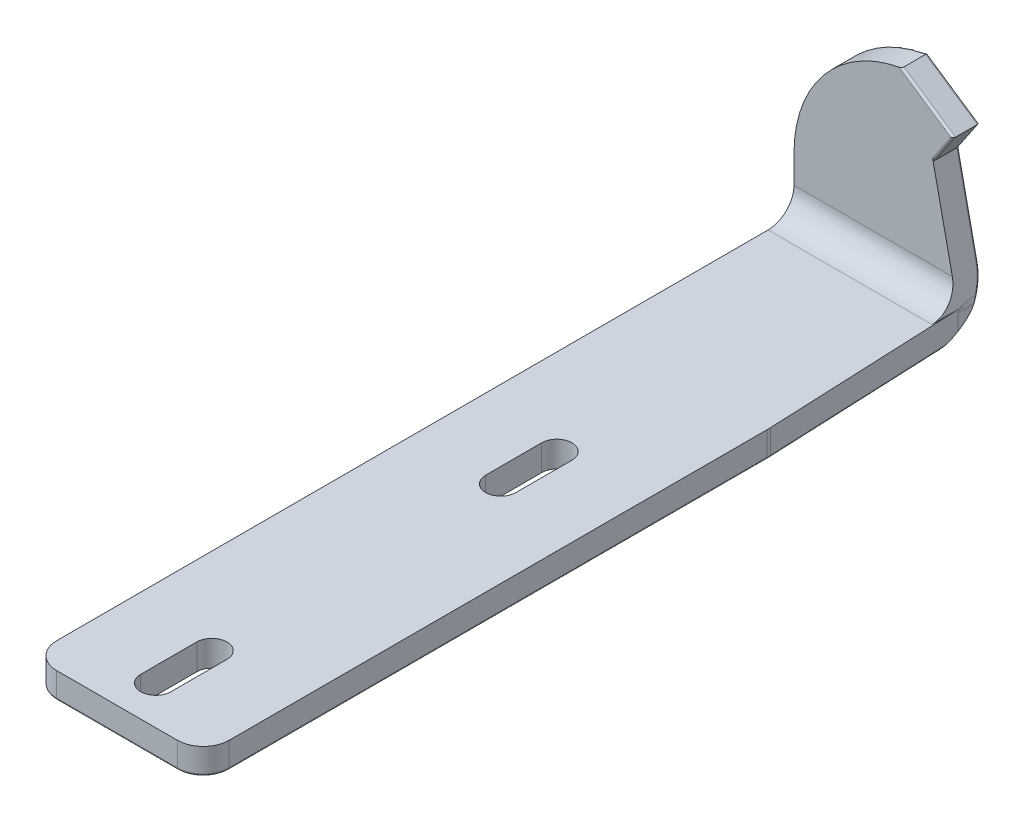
SolidWorks part; units mm, degrees
ref_plane "Face" through (0, 0, 0) normal (0, 0, 1) x (1, 0, 0)
ref_plane "Dessus" through (0, 0, 0) normal (0, 1, 0) x (1, 0, 0)
ref_plane "Droite" through (0, 0, 0) normal (1, 0, 0) x (0, 0, -1)
sketch "Esquisse1" plane through (0, 0, 0) normal (0, 0, 1) x (1, 0, 0)
  line L0 (0, 0) -> (0, 9.2098)
  line L1 (0, 0) -> (19, 0)
  line L2 (19, 0) -> (19, 3)
  line L3 (12.5, 24) -> (18.5, 19.9529)
  line L4 (0, 3) -> (21.0892, 3) construction
  line L5 (-2.1556, 24) -> (12.5, 24) construction
  line L6 (18.5, 25.5506) -> (18.5, 19.9529) construction
  line L7 (18.5, 19.9529) -> (16.1402, 16.4544)
  line L8 (19, 3) -> (16.1402, 16.4544)
  arc A0 (0, 9.2098) -> (12.5, 24) centre (15, 9.2098) cw
  dimension "D5" = 15
  dimension "D6" = 18.5
  dimension "D1" = 19
  dimension "D2" = 24
  dimension "D3" = 12.5
  dimension "D4" = 3
  dimension "D7" = 78
  dimension "D8" = 34
extrude "Base-Extrusion" add sketch "Esquisse1" along normal blind 3
sketch "Esquisse2" plane through (0, 0, 0) normal (0, 0, -1) x (-1, 0, 0)
  line L1 (0, 0) -> (-20, 0)
  line L2 (0, 0) -> (0, 3)
  line L3 (0, 3) -> (-20, 3)
  line L4 (-20, 0) -> (-20, 3)
  dimension "D1" = 3
  dimension "D2" = 20
extrude "Boss.-Extru.1" add sketch "Esquisse2" against normal blind 91.5
fillet "Congé1" radius 3 2 edges at (0, 1.5, 91.5) (20, 1.5, 91.5)
sketch "Esquisse3" plane through (0, 3, 0) normal (0, 1, 0) x (-1, 0, 0)
  line L1 (-19, 3) -> (-20.5, 37.3556)
  line L2 (-19, 3) -> (-19, 0) construction
  line L3 (-19, 3) -> (-19, 0)
  line L4 (-20.5, 37.3556) -> (-20.5, 0)
  line L5 (-20.5, 0) -> (-19, 0)
  dimension "D1" = 1.5
  dimension "D2" = 2.5
extrude "Enlèv. mat.-Extru.1" cut sketch "Esquisse3" against normal through all
fillet "Congé3" radius 10 1 edges at (20, 1.5, 25.9038)
fillet "Congé6" radius 6 3 edges at (19, 0, 1.5) (19, 1.5, 0) (9.5, 0, 0)
fillet "Congé9" radius 0.25 15 edges at (0, 0, 47.25) (10, 0, 91.5) (20, 0, 57.311) (19.1213, 0, 90.6213) (0.8787, 0, 90.6213) (0, 7.6049, 0) (3.5436, 18.8923, 0) (15.5, 21.9765, 0) (19.9976, 0, 25.9038) (17.3201, 18.2037, 0) (19.5607, 0, 15.8429) (19.0632, 0.2044, 4.4471) (17.2513, 11.2272, 0) (18.6924, 4.4471, 0.2044) (0, 1.7574, 1.7574)
fillet "Congé38" radius 3 2 edges at (18.6888, 4.4643, 0.4735) (19, 3, 2.0634)
fillet "Congé46" radius 3 1 edges at (9.5, 3, 3)
fillet "Congé54" radius 0.25 2 edges at (17.3201, 18.2037, 3) (15.5, 21.9765, 3)
sketch "Esquisse4" plane through (0, 3, 0) normal (0, 1, 0) x (-1, 0, 0)
  line L0 (-18.5, 0.25) -> (-12.5, 0.25) construction
  line L1 (-18.5, 0.25) -> (-12.5, 0.25) construction
  line L2 (-20, 88.5) -> (-20, 26.122) construction
  line L3 (-20, 43.75) -> (-20, 26.122) construction
  line L4 (-4.1796, 43.75) -> (-24.2174, 43.75) construction
  line L6 (-10, 10.2713) -> (-10, 82.7451) construction
  line L7 (-11.75, 40.5) -> (-11.75, 47)
  line L9 (-8.25, 47) -> (-8.25, 40.5)
  arc A0 (-8.25, 47) -> (-11.75, 47) centre (-10, 47) ccw
  arc A1 (-11.75, 40.5) -> (-8.25, 40.5) centre (-10, 40.5) ccw
  dimension "D4" = 3.25
  dimension "D1" = 10
  dimension "D2" = 43.5
  dimension "D3" = 3.5
  dimension "D5" = 3.25
extrude "Enlèv. mat.-Extru.2" cut sketch "Esquisse4" against normal through all
pattern_linear "Répétition linéaire2" count 2 spacing 40 along (0, 0, 1) of "Enlèv. mat.-Extru.2"
sketch "Esq_WRNL_Compact001" plane through (0, 0, 0) normal (0, 0, 1) x (1, 0, 0)
  line L0 (-1, -1) -> (-1, 25.0289)
  line L1 (21, -1) -> (21, 25.0289)
  line L2 (-1, -1) -> (21, -1)
  line L3 (-1, 25.0289) -> (21, 25.0289)
